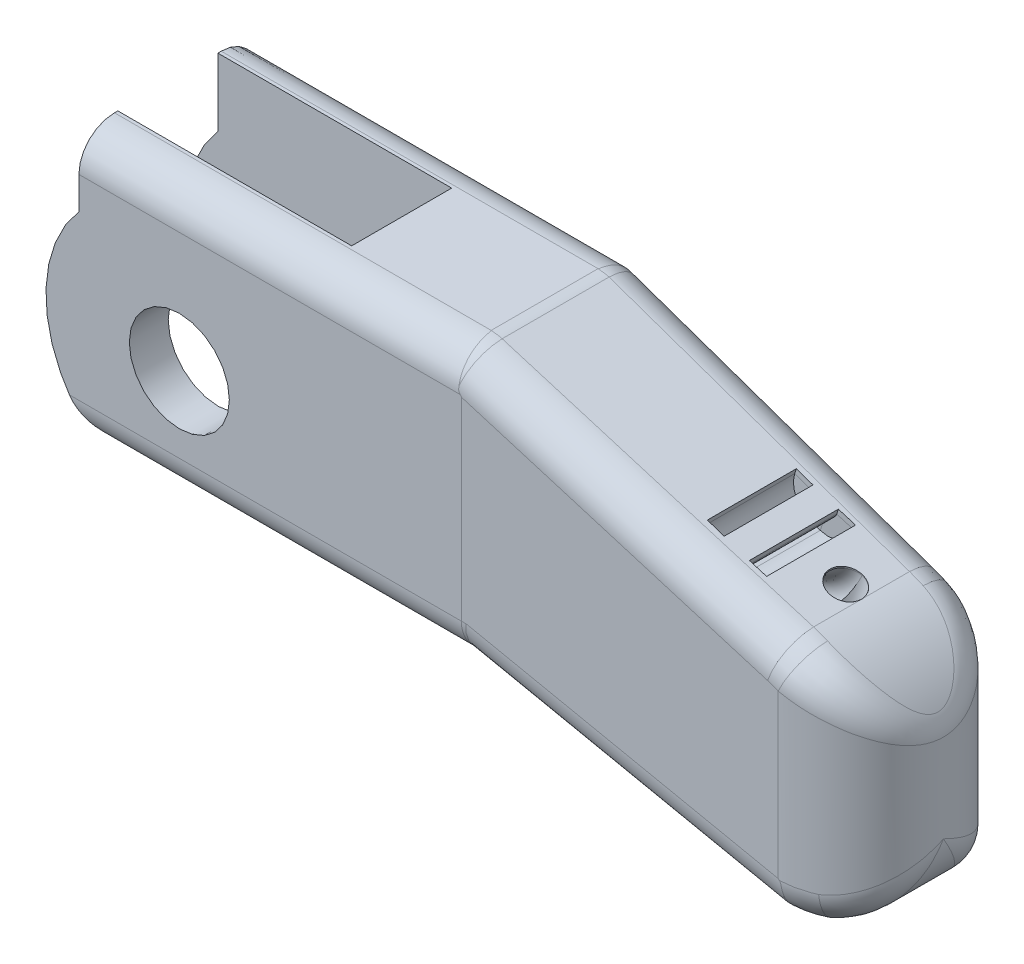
SolidWorks part; units mm, degrees
ref_plane "Front Plane" through (0, 0, 0) normal (0, 0, 1) x (1, 0, 0)
ref_plane "Top Plane" through (0, 0, 0) normal (0, 1, 0) x (1, 0, 0)
ref_plane "Right Plane" through (0, 0, 0) normal (1, 0, 0) x (0, 0, -1)
sketch "Sketch1" plane through (0, 0, 0) normal (0, 1, 0) x (1, 0, 0)
  line L0 (25.4, 12.7) -> (47.625, 12.3031)
  line L1 (0, 0) -> (25.4, 0)
  line L2 (0, 0) -> (0, 12.7)
  line L3 (0, 12.7) -> (25.4, 12.7)
  line L5 (47.625, 0.3969) -> (25.4, 0)
  arc A0 (47.625, 12.3031) -> (47.625, 0.3969) centre (47.5187, 6.35) cw
  point P9 (0, 6.35)
  dimension "D1" = 12.7
  dimension "D2" = 11.9062
  dimension "D3" = 25.4
  dimension "D4" = 22.225
extrude "Boss-Extrude1" add sketch "Sketch1" along normal blind 24.13
sketch "Sketch3" plane through (0, 0, 0) normal (0, 0, 1) x (1, 0, 0)
  line L0 (25.4, 24.13) -> (25.4, 0) construction
  line L1 (0, 0) -> (31.75, 0)
  line L2 (0, 0) -> (0, 5.08)
  line L3 (0, 5.08) -> (25.4, 5.08)
  line L5 (25.4, 5.08) -> (47.625, 0)
  line L6 (47.625, 0) -> (31.75, 0)
  dimension "D1" = 19.05
extrude "Cut-Extrude1" cut sketch "Sketch3" against normal through all
sketch "Sketch4" plane through (0, 0, 0) normal (0, 0, 1) x (1, 0, 0)
  line L0 (25.4, 24.13) -> (47.625, 16.9111)
  line L1 (47.625, 24.13) -> (47.625, 0) construction
  line L2 (53.4728, 0) -> (53.4728, 24.13) construction
  line L3 (53.4728, 11.9883) -> (53.4728, 24.13)
  line L4 (53.4728, 24.13) -> (25.4, 24.13)
  arc A0 (47.625, 16.9111) -> (53.4728, 11.9883) centre (44.4863, 7.248) cw
  dimension "D2" = 10.16
  dimension "D1" = 23.368
extrude "Cut-Extrude2" cut sketch "Sketch4" against normal through all
sketch "Sketch5" plane through (0, 0, 0) normal (0, 0, 1) x (1, 0, 0)
  line L2 (49.1548, 0) -> (53.4728, 0)
  line L3 (53.4728, 0) -> (53.4728, 5.0225)
  arc A0 (53.4728, 5.0225) -> (49.1548, 0) centre (48.3928, 5.0225) cw
  dimension "D1" = 5.08
  dimension "D2" = 4.318
extrude "Cut-Extrude3" cut sketch "Sketch5" against normal through all
sketch "Sketch7" plane through (0, 0, 0) normal (0, 0, 1) x (1, 0, 0)
  line L0 (0, 20.955) -> (0, 5.08)
  line L1 (0, 20.955) -> (0, 24.13)
  line L2 (0, 24.13) -> (25.4, 24.13) construction
  line L3 (0, 24.13) -> (-1.905, 24.13)
  line L4 (-1.905, 24.13) -> (-1.905, 19.2876)
  arc A1 (-1.905, 19.2876) -> (0, 5.08) centre (5.2651, 13.0175) ccw
  dimension "D2" = 19.05
  dimension "D1" = 3.175
  dimension "D3" = 1.905
  dimension "D4" = 4.8424
ref_plane "Plane1" through (0, 0, -6.35) normal (0, 0, 1) x (1, 0, 0)
extrude "Boss-Extrude4" add sketch "Sketch7" against normal up to surface (12.7 mm away)
sketch "Sketch9" plane through (0, 24.13, 0) normal (0, 1, 0) x (1, 0, 0)
  line L0 (-13.9922, 6.35) -> (13.9922, 6.35) construction
  line L5 (-4.2599, 2.7781) -> (14.7901, 2.7781)
  line L6 (-4.2599, 2.7781) -> (-4.2599, 9.9219)
  line L7 (-4.2599, 9.9219) -> (14.7901, 9.9219)
  line L8 (14.7901, 2.7781) -> (14.7901, 9.9219)
  line L11 (-4.2599, 12.7) -> (-4.2599, 0) construction
  point P4 (14.7901, 6.35)
  dimension "D1" = 7.1437
  dimension "D2" = 19.05
extrude "Cut-Extrude5" cut sketch "Sketch9" against normal through all
fillet "Fillet1" radius 2.54 3 edges at (36.5125, 20.5205, -12.5016) (53.4258, 12.0763, -7.0964) (36.5125, 20.5205, -0.1984)
sketch "Sketch10" plane through (0, 0, 0) normal (0, 0, 1) x (1, 0, 0)
  circle A0 centre (5.2651, 13.0175) radius 3.5719
  arc A1 (-1.905, 19.2876) -> (0, 5.08) centre (5.2651, 13.0175) ccw construction
  dimension "D1" = 7.1437
extrude "Cut-Extrude6" cut sketch "Sketch10" against normal through all
sketch "Sketch11" plane through (14.7901, 0, 0) normal (-1, 0, 0) x (0, 0, 1)
  line L0 (-6.35, -13.9922) -> (-6.35, 13.9922) construction
  line L1 (-2.7781, 24.13) -> (-9.9219, 24.13) construction
  circle A0 centre (-6.35, 22.225) radius 1.1906
  dimension "D1" = 2.3813
  dimension ".075" = 1.905
sketch "Sketch12" plane through (0, 0, -6.35) normal (0, 0, 1) x (1, 0, 0)
  line L0 (25.4, 18.2486) -> (14.7901, 21.0344)
  line L1 (47.625, 16.9111) -> (50.2659, 21.5675)
  line L2 (25.4, 21.4741) -> (25.4, 5.08) construction
  line L3 (25.4, 18.2486) -> (39.3778, 13.7084)
  line L5 (46.8857, 14.4953) -> (25.4, 21.4741) construction
  arc A0 (39.3778, 13.7084) -> (47.625, 16.9111) centre (41.5392, 20.3627) ccw
  dimension "D2" = 6.9965
  dimension "D1" = 3.0677
  dimension "D3" = 4.6564
sweep "Cut-Sweep1" cut profiles "Sketch11" path "Sketch12"
sketch "Sketch13" plane through (9.5137, 29.29, 0) normal (0.3089, 0.9511, 0) x (0.9511, -0.3089, 0)
  line L0 (16.7033, 10.1736) -> (16.7033, 2.5264) construction
  line L1 (34.9915, 9.525) -> (36.2613, 9.5466)
  line L2 (34.9915, 9.525) -> (34.9915, 3.175)
  line L3 (34.9915, 3.175) -> (36.2613, 3.1966)
  line L4 (36.2613, 9.5466) -> (36.2613, 3.1966)
  line L5 (16.7033, 2.5264) -> (40.0713, 2.9233) construction
  line L6 (40.0713, 6.35) -> (31.863, 6.35) construction
  line L8 (40.0713, 6.35) -> (40.0713, 2.9233) construction
  point P8 (36.2613, 6.3716)
  point P11 (16.7033, 6.35)
  point P14 (34.9915, 6.35)
  dimension "D1" = 6.35
  dimension "D2" = 1.27
  dimension "D3" = 3.81
sketch "Sketch14" plane through (0, 0, -6.35) normal (0, 0, 1) x (1, 0, 0)
  line L1 (42.7937, 18.4804) -> (42.676, 18.118)
  line L2 (47.625, 16.9111) -> (39.8182, 19.4468) construction
  line L3 (41.8758, 17.7102) -> (41.2719, 17.9064)
  line L4 (40.8641, 18.7065) -> (40.9818, 19.0689)
  arc A0 (42.676, 18.118) -> (41.8758, 17.7102) centre (42.072, 18.3142) cw
  arc A1 (41.2719, 17.9064) -> (40.8641, 18.7065) centre (41.4681, 18.5103) cw
  point P9 (42.4798, 17.514)
  point P12 (40.668, 18.1025)
  dimension "D3" = 0.635
  dimension "D1" = 1.905
  dimension "D2" = 1.016
sweep "Cut-Sweep2" cut profiles "Sketch13" path "Sketch14"
sketch "Sketch15" plane through (14.7901, 0, 0) normal (-1, 0, 0) x (0, 0, 1)
  line L0 (-6.35, -13.9922) -> (-6.35, 13.9922) construction
  line L1 (-2.7781, 5.08) -> (-9.9219, 5.08) construction
  circle A0 centre (-6.35, 6.985) radius 1.1906
  dimension "D1" = 2.3812
  dimension "D2" = 1.905
sketch "Sketch16" plane through (0, 0, -6.35) normal (0, 0, 1) x (1, 0, 0)
  line L0 (14.7901, 8.1756) -> (19.8701, 11.5938)
  line L3 (19.8701, 11.5938) -> (25.4, 11.5938)
  line L4 (25.4, 21.4741) -> (25.4, 5.08) construction
  line L5 (25.4, 11.5938) -> (37.7807, 8.7639)
  line L6 (25.4, 5.08) -> (47.625, 0) construction
  line L7 (25.4, 5.08) -> (0, 5.08) construction
  arc A0 (37.7807, 8.7639) -> (42.5561, 1.1586) centre (36.3658, 2.5735) cw
  dimension "D1" = 5.08
  dimension "D2" = 5.0689
  dimension "D3" = 6.35
sweep "Cut-Sweep5" cut profiles "Sketch15" path "Sketch16"
sketch "Sketch17" plane through (2.3646, 10.3452, 0) normal (-0.2228, -0.9749, 0) x (0.9749, -0.2228, 0)
  line L0 (30.7439, -6.35) -> (46.4276, -6.35) construction
  line L1 (36.7756, -3.175) -> (38.0456, -3.175)
  line L2 (36.7756, -3.175) -> (36.7756, -9.525)
  line L3 (36.7756, -9.525) -> (38.0456, -9.525)
  line L4 (38.0456, -3.175) -> (38.0456, -9.525)
  line L5 (13.9922, -6.35) -> (-13.9922, -6.35) construction
  line L6 (46.4276, -12.3031) -> (46.4276, -0.3969) construction
  point P10 (36.7756, -6.35)
  dimension "D1" = 6.35
  dimension "D2" = 1.27
  dimension "D3" = 8.382
sketch "Sketch19" plane through (0, 0, -6.35) normal (0, 0, 1) x (1, 0, 0)
  line L0 (36.3586, 2.5752) -> (36.4435, 2.9466)
  line L1 (32.3356, 3.4947) -> (47.625, 0) construction
  line L2 (37.204, 3.4241) -> (37.823, 3.2827)
  line L3 (38.3006, 2.5221) -> (38.2157, 2.1507)
  arc A0 (37.823, 3.2827) -> (38.3006, 2.5221) centre (37.6815, 2.6636) cw
  arc A1 (36.4435, 2.9466) -> (37.204, 3.4241) centre (37.0625, 2.8051) cw
  point P8 (38.4421, 3.1412)
  point P11 (36.585, 3.5656)
  dimension "D3" = 0.635
  dimension "D1" = 1.016
  dimension "D2" = 1.905
sweep "Cut-Sweep6" cut profiles "Sketch17" path "Sketch19"
fillet "Fillet5" radius 2.54 5 edges at (25.4, 24.13, -6.35) (23.7787, 24.13, -11.7145) (23.7787, 24.13, -0.9855) (8.8246, 24.13, 0) (8.8246, 24.13, -12.7)
fillet "Fillet6" radius 2.54 6 edges at (36.5125, 2.54, -12.5016) (48.3973, 0, -0.4611) (48.3973, 0, -12.2389) (52.009, 1.4547, -10.26) (52.009, 1.4547, -2.44) (36.5125, 2.54, -0.1984)
fillet "Fillet7" radius 2.54 4 edges at (31.1222, 5.08, -12.5978) (12.7, 5.08, -12.7) (31.1222, 5.08, -0.1022) (12.7, 5.08, 0)
sketch "Sketch23" plane through (9.5137, 29.29, 0) normal (0.3089, 0.9511, 0) x (0.9511, -0.3089, 0)
  line L0 (-13.9922, 6.35) -> (13.9922, 6.35) construction
  line L1 (40.0713, 9.7767) -> (40.0713, 6.35) construction
  circle A0 centre (38.8807, 6.35) radius 1.1906
  dimension "D1" = 2.3813
sketch "Sketch24" plane through (0, 0, -6.35) normal (0, 0, 1) x (1, 0, 0)
  line L0 (47.625, 16.9111) -> (42.556, 1.1588)
  spline S1 degree 3 poles (42.556, 1.1586) (42.5801, 1.265) (42.6023, 1.3731) (42.7876, 2.4368) (42.7398, 3.5203) (42.0531, 5.6032) (41.4103, 6.5866) (39.7515, 8.0589) (38.7515, 8.542) (37.7807, 8.7639) knots 0.505811 0.505811 0.505811 0.505811 0.520139 0.520139 0.643686 0.643686 0.767234 0.767234 0.890781 0.890781 0.890781 0.890781 weights 0.5 0.5 0.5 0.5 0.5 0.5 0.5 0.5 0.5 0.5 construction
  dimension "D1" = 15.7523
sweep "Cut-Sweep12" cut profiles "Sketch23" path "Sketch24"
